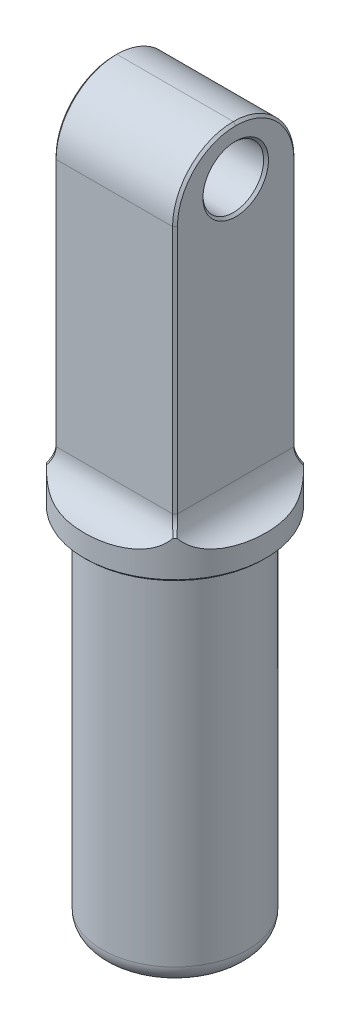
SolidWorks part; units mm, degrees
ref_plane "Top Plane" through (0, 0, 0) normal (0, 0, 1) x (1, 0, 0)
ref_plane "Front Plane" through (0, 0, 0) normal (0, 1, 0) x (1, 0, 0)
ref_plane "Right Plane" through (0, 0, 0) normal (1, 0, 0) x (0, 0, -1)
sketch "Sketch1" plane through (0, 0, 0) normal (0, 1, 0) x (1, 0, 0)
  line L1 (-5, -5) -> (5, -5) construction
  line L2 (-5, -5) -> (-5, 5) construction
  line L3 (-5, 5) -> (5, 5) construction
  line L4 (5, -5) -> (5, 5) construction
  line L5 (-5, -5) -> (5, 5) construction
  line L6 (-5, 5) -> (5, -5) construction
  circle A0 centre (0, 0) radius 7.0711
  dimension "D1" = 10
extrude "Boss-Extrude1" add sketch "Sketch1" along normal blind 25 contours A0
sketch "Sketch4" plane through (0, 0, 0) normal (0, -1, 0) x (1, 0, 0)
  circle A0 centre (0, 0) radius 7.5
  dimension "D1" = 15
extrude "Boss-Extrude3" add sketch "Sketch4" along normal blind 5
sketch "Sketch5" plane through (0, -5, 0) normal (0, -1, 0) x (-1, 0, 0)
  circle A0 centre (0, 0) radius 6
  dimension "D1" = 12
extrude "Boss-Extrude4" add sketch "Sketch5" along normal blind 30
sketch "Sketch3" plane through (0, 25, 0) normal (0, 1, 0) x (1, 0, 0)
  line L1 (-5, -5) -> (5, -5)
  line L2 (-5, -5) -> (-5, 5)
  line L3 (-5, 5) -> (5, 5)
  line L4 (5, -5) -> (5, 5)
  line L5 (-5, -5) -> (5, 5) construction
  line L6 (-5, 5) -> (5, -5) construction
  circle A0 centre (0, 0) radius 18.8855
  point P0 (0, 0)
  dimension "D1" = 10
extrude "Cut-Extrude1" cut sketch "Sketch3" against normal blind 28
fillet "Fillet1" radius 2.5 4 edges at (-5, -3, 0) (0, -3, -5) (5, -3, 0) (0, -3, 5)
sketch "Sketch7" plane through (5, 0, 0) normal (1, 0, 0) x (0, 0, -1)
  line L0 (0, 25) -> (0, -0.5) construction
  line L1 (-5, 25) -> (5, 25) construction
  line L2 (-5, -0.5) -> (5, -0.5) construction
  circle A0 centre (0, 21) radius 2.5
  point P2 (0, 19.5931)
  dimension "D2" = 5
  dimension "D1" = 4
extrude "Cut-Extrude2" cut sketch "Sketch7" against normal up to next
fillet "Fillet2" radius 5 2 edges at (0, 25, -5) (0, 25, 5)
fillet "Fillet3" radius 1.5 1 edges at (0, -35, -6)
chamfer "Chamfer2" distance 0.2 angle 45 1 edges at (0, -5, -7.5)
chamfer "Chamfer3" distance 0.2 angle 45 2 edges at (-5, 21, 2.5) (5, 21, -2.5)
chamfer "Chamfer4" distance 0.2 angle 45 12 edges at (5, 9.75, -5) (-5, 9.75, -5) (5.077, -1.1157, -5.077) (5, 23.5355, -3.5355) (5.077, -1.1157, 5.077) (5, 23.5355, 3.5355) (5, 9.75, 5) (-5.077, -1.1157, -5.077) (-5, 23.5355, -3.5355) (-5.077, -1.1157, 5.077) (-5, 23.5355, 3.5355) (-5, 9.75, 5)
